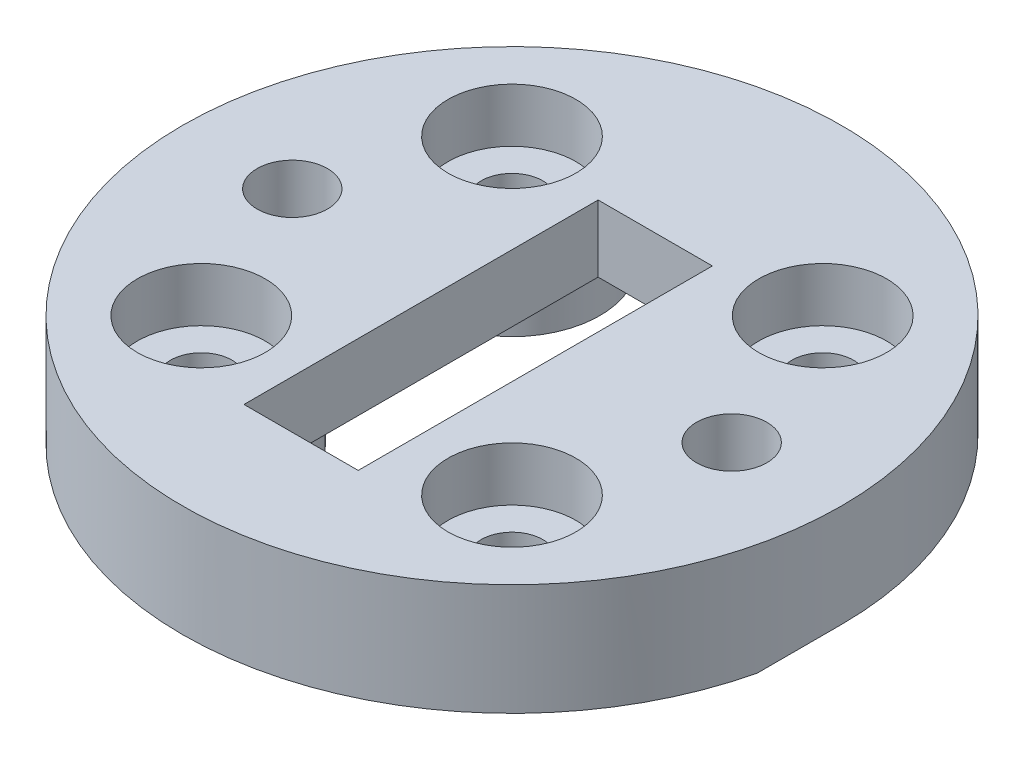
SolidWorks part; units mm, degrees
ref_plane "Front Plane" through (0, 0, 0) normal (0, 0, 1) x (1, 0, 0)
ref_plane "Top Plane" through (0, 0, 0) normal (0, 1, 0) x (1, 0, 0)
ref_plane "Right Plane" through (0, 0, 0) normal (1, 0, 0) x (0, 0, -1)
sketch "Sketch1-dovetail_male" plane through (0, 0, 0) normal (0, 0, 1) x (1, 0, 0)
  line L0 (0, 0) -> (0, 12) construction
  line L1 (-18.5, 12) -> (-18.5, 9)
  line L2 (-18.5, 9) -> (-12.5, 3)
  line L3 (-12.5, 3) -> (-12.5, 0)
  line L4 (12.5, 3) -> (12.5, 0)
  line L5 (18.5, 9) -> (12.5, 3)
  line L6 (18.5, 12) -> (18.5, 9)
  line L7 (-18.5, 12) -> (18.5, 12)
  line L8 (-12.5, 0) -> (12.5, 0)
  dimension "D1" = 12
  dimension "D2" = 3
  dimension "D3" = 45
  dimension "D4" = 25
sketch "Sketch9-dovetail_male" plane through (0, 0, -30) normal (0, 0, -1) x (-1, 0, 0)
  line L0 (0, 12) -> (0, 0) construction
  line L1 (-18.5, 12) -> (-12.5, 12)
  line L2 (-18.5, 12) -> (-18.5, 0)
  line L3 (-18.5, 0) -> (-12.5, 0)
  line L4 (-12.5, 12) -> (-12.5, 0)
  line L7 (12.5, 12) -> (12.5, 0)
  line L8 (18.5, 0) -> (12.5, 0)
  line L9 (18.5, 12) -> (18.5, 0)
  line L10 (18.5, 12) -> (12.5, 12)
sketch "Sketch10-dovetail_male" plane through (12.5, 0, 0) normal (1, 0, 0) x (0, 0, -1)
  line L0 (25, 12) -> (25, 0) construction
  circle A0 centre (25, 6) radius 2.7
  dimension "4" = 5.4
sketch "Sketch11-dovetail_male" plane through (0, 0, 0) normal (0, -1, 0) x (1, 0, 0)
  line L0 (0, -16.3) -> (0, 0) construction
  line L1 (6.5, -16.3) -> (-6.5, -16.3)
  line L2 (6.5, -16.3) -> (6.5, 24)
  line L3 (6.5, 24) -> (-6.5, 24)
  line L4 (-6.5, -16.3) -> (-6.5, 24)
  line L8 (12.5, -27.7) -> (12.5, -22.3) construction
  dimension "D3" = 6
inserted part "dovetail_male"
sketch "Sketch5" plane through (0, 0, 0) normal (0, -1, 0) x (1, 0, 0)
  circle A0 centre (0, 0) radius 37.5
  dimension "D1" = 75
extrude "UR Wrist Body" add sketch "Sketch5" along normal blind 1.5
sketch "Sketch16" plane through (0, -1.5, 0) normal (0, -1, 0) x (1, 0, 0)
  circle A0 centre (0, 0) radius 37.5
  circle A1 centre (0, 0) radius 37.5 construction
extrude "Boss-Extrude2" add sketch "Sketch16" along normal offset from surface (11.43 mm away) 12.93
sketch "Sketch26" plane through (0, 0, 0) normal (0, 1, 0) x (1, 0, 0)
  line L1 (-37.5, 0) -> (37.5, 0)
  line L2 (-37.5, 0) -> (-37.5, -60)
  line L3 (-37.5, -60) -> (37.5, -60)
  line L4 (37.5, 0) -> (37.5, -60)
  circle A0 centre (0, 0) radius 37.5 construction
  dimension "D1" = 60
extrude "Boss-Extrude4" add sketch "Sketch26" against normal up to surface (12.93 mm away)
sketch "Sketch22" plane through (0, -12.93, 0) normal (0, -1, 0) x (1, 0, 0)
  line L0 (32.5, 18.7083) -> (32.5, 55)
  line L1 (32.5, 55) -> (5, 55)
  line L2 (-32.5, 55) -> (-32.5, 18.7083)
  line L3 (32.5, 55) -> (37.5, 55) construction
  line L4 (37.5, 60) -> (37.5, 0) construction
  line L5 (32.5, 55) -> (32.5, 60) construction
  line L6 (-37.5, 60) -> (37.5, 60) construction
  line L7 (0, 37.1652) -> (0, 55) construction
  line L8 (5, 37.1652) -> (5, 55)
  line L9 (-5, 37.1652) -> (-5, 55)
  line L10 (-5, 55) -> (-32.5, 55)
  line L11 (-5, 0) -> (5, 0) construction
  line L12 (0, 0) -> (32.9658, 32.9658) construction
  line L13 (0, 0) -> (-29.7332, 29.7332) construction
  line L14 (0, 0) -> (-30.6641, -30.6641) construction
  line L15 (0, 0) -> (36.6284, -36.6284) construction
  arc A4 (32.5, 18.7083) -> (5, 37.1652) centre (0, 0) ccw
  arc A5 (-5, 37.1652) -> (-32.5, 18.7083) centre (0, 0) ccw
  arc A6 (20.1885, 27.3573) -> (-20.1885, 27.3573) centre (0, 0) ccw
  arc A11 (20.1885, 27.3573) -> (18.6499, 7.725) centre (17.6777, 17.6777) ccw
  arc A12 (-27.3573, 20.1885) -> (-24.0278, 9.9526) centre (-17.6777, 17.6777) ccw
  arc A13 (-20.1885, -27.3573) -> (-18.6499, -7.725) centre (-17.6777, -17.6777) ccw
  arc A14 (27.3573, -20.1885) -> (24.0278, -9.9526) centre (17.6777, -17.6777) ccw
  arc A15 (-27.3573, 20.1885) -> (-33.62, 5.0691) centre (0, 0) ccw
  arc A16 (-20.1885, -27.3573) -> (20.1885, -27.3573) centre (0, 0) ccw
  arc A17 (27.3573, -20.1885) -> (33.62, -5.0691) centre (0, 0) ccw
  arc A18 (18.6499, 7.725) -> (18.6499, -7.725) centre (25, 0) ccw
  arc A19 (-18.6499, -7.725) -> (-18.6499, 7.725) centre (-25, 0) ccw
  arc A20 (24.0278, 9.9526) -> (27.3573, 20.1885) centre (17.6777, 17.6777) ccw
  arc A21 (33.62, 5.0691) -> (27.3573, 20.1885) centre (0, 0) ccw
  arc A22 (33.62, 5.0691) -> (24.0278, 9.9526) centre (25, 0) ccw
  arc A23 (18.6499, -7.725) -> (20.1885, -27.3573) centre (17.6777, -17.6777) ccw
  arc A24 (24.0278, -9.9526) -> (33.62, -5.0691) centre (25, 0) ccw
  arc A25 (-24.0278, -9.9526) -> (-27.3573, -20.1885) centre (-17.6777, -17.6777) ccw
  arc A26 (-33.62, -5.0691) -> (-27.3573, -20.1885) centre (0, 0) ccw
  arc A27 (-33.62, -5.0691) -> (-24.0278, -9.9526) centre (-25, 0) ccw
  arc A28 (-18.6499, 7.725) -> (-20.1885, 27.3573) centre (-17.6777, 17.6777) ccw
  arc A29 (-24.0278, 9.9526) -> (-33.62, 5.0691) centre (-25, 0) ccw
  dimension "D1" = 45
  dimension "D2" = 90
  dimension "D3" = 75
  dimension "D7" = 68
  dimension "D8" = 90
  dimension "D10" = 20
  dimension "D15" = 20
  dimension "D16" = 20
  dimension "D6" = 5
  dimension "D9" = 90
  dimension "D11" = 25
  dimension "D12" = 25
  dimension "D13" = 25
  dimension "D14" = 25
  dimension "D17" = 25
  dimension "D18" = 25
  dimension "D4" = 5
  dimension "D5" = 5
extrude "Cut-Extrude7" cut sketch "Sketch22" against normal blind 5.08
sketch "Sketch13" plane through (0, 0, 0) normal (0, 1, 0) x (1, 0, 0)
  line L5 (-6.5, -24) -> (6.5, -24)
  line L6 (6.5, -24) -> (6.5, 16.3)
  line L7 (6.5, 16.3) -> (-6.5, 16.3)
  line L8 (-6.5, 16.3) -> (-6.5, -24)
  line L9 (-6.5, -24) -> (6.5, -24)
  line L10 (6.5, -24) -> (6.5, 16.3)
  line L11 (6.5, 16.3) -> (-6.5, 16.3)
  line L12 (-6.5, 16.3) -> (-6.5, -24)
  dimension "D1" = 0
extrude "Clearance Continuation" cut sketch "Sketch13" against normal through all
fillet "Fillet3" radius 0.5 13 edges at (0, 12, -30) (18.3536, 12, -19.8536) (12.3536, 12, -29.8536) (-12.3536, 12, -29.8536) (-18.3536, 12, -19.8536) (12.6464, 12, -20.1464) (-12.6464, 12, -20.1464) (18.5, 12, 5.25) (-18.5, 12, 5.25) (15.5, 12, -20) (12.5, 12, -25) (-15.5, 12, -20) (-12.5, 12, -25)
sketch "Sketch18" plane through (12.5, 0, 0) normal (1, 0, 0) x (0, 0, -1)
  circle A0 centre (25, 6) radius 2
  circle A1 centre (25, 6) radius 3
  dimension "D1" = 4
  dimension "D2" = 6
extrude "Boss-Extrude3" add sketch "Sketch18" against normal up to surface (25 mm away)
sketch "Sketch19" plane through (0, 0, 0) normal (0, 0, 1) x (1, 0, 0)
  line L13 (-12, 0.5) -> (-12, -0.25)
  line L14 (-12, -0.25) -> (-41.8538, -0.25)
  line L15 (-41.8538, -0.25) -> (-41.8538, 17.9915)
  line L16 (-41.8538, 17.9915) -> (46.2765, 17.9915)
  line L17 (46.2765, 17.9915) -> (46.2765, -0.25)
  line L18 (46.2765, -0.25) -> (12, -0.25)
  line L19 (12, -0.25) -> (12, 0.5)
  line L20 (37.5, 0) -> (-37.5, 0) construction
  line L25 (18, 11.5) -> (-18, 11.5)
  line L26 (-18, 11.5) -> (-18, 9.2071)
  line L27 (-18, 9.2071) -> (-12.2929, 3.5)
  line L28 (-12, 2.7929) -> (-12, 0.5)
  line L29 (-12, 0.5) -> (12, 0.5)
  line L34 (12, 0.5) -> (12, 2.7929)
  line L35 (12.2929, 3.5) -> (18, 9.2071)
  line L36 (18, 9.2071) -> (18, 11.5)
  line L37 (18, 11.5) -> (-18, 11.5)
  line L38 (-18, 11.5) -> (-18, 9.2071)
  line L39 (-18, 9.2071) -> (-12.2929, 3.5)
  line L40 (-12, 2.7929) -> (-12, 0.5)
  line L46 (12, 0.5) -> (12, 2.7929)
  line L47 (12.2929, 3.5) -> (18, 9.2071)
  line L48 (18, 9.2071) -> (18, 11.5)
  arc A14 (-12, 2.7929) -> (-12.2929, 3.5) centre (-13, 2.7929) ccw
  arc A15 (12.2929, 3.5) -> (12, 2.7929) centre (13, 2.7929) ccw
  arc A20 (-12, 2.7929) -> (-12.2929, 3.5) centre (-13, 2.7929) ccw
  arc A21 (12.2929, 3.5) -> (12, 2.7929) centre (13, 2.7929) ccw
  dimension "D2" = 0.25
  dimension "D1" = 0.5
extrude "Cut-Extrude3" cut sketch "Sketch19" against normal through all both and the other way through all
sketch "Sketch20" plane through (0, 0, 0) normal (0, 1, 0) x (1, 0, 0)
  line L0 (-12, 30) -> (13.1672, 30)
  line L1 (-12, 35.5282) -> (-12, 30) construction
  line L2 (13.1672, 30) -> (13.1672, 40.874)
  line L3 (13.1672, 40.874) -> (-13.6423, 40.874)
  line L4 (-13.6423, 40.874) -> (-12, 30)
  line L8 (-12, 30) -> (12, 30) construction
  line L9 (16.047, -54.6038) -> (15.4806, -30)
  line L10 (15.4806, -30) -> (-15.5069, -30)
  line L11 (-15.5069, -30) -> (-15.5069, -92.5118)
  line L12 (-15.5069, -92.5118) -> (15.0938, -93.6994)
  line L13 (-12, -30) -> (12, -30) construction
extrude "Cut-Extrude4" cut sketch "Sketch20" against normal up to surface (0.25 mm away)
fillet "Fillet6" radius 12.5 2 edges at (-37.5, -6.59, 60) (37.5, -6.59, 60)
chamfer "Chamfer1" distance 1 angle 45 6 edges at (0, -12.93, -37.5) (-37.5, -12.93, 23.75) (37.5, -12.93, 23.75) (0, -12.93, 60) (-33.8388, -12.93, 56.3388) (33.8388, -12.93, 56.3388)
sketch "Sketch23" plane through (0, 11.5, 0) normal (0, 1, 0) x (1, 0, 0)
  line L0 (12, 30) -> (-12, 30) construction
  line L1 (12, 30) -> (14.133, 30)
  line L2 (12, 30) -> (12, 20)
  line L3 (12, 20) -> (14.133, 20)
  line L4 (14.133, 30) -> (14.133, 20)
  line L5 (18, 20) -> (13, 20) construction
  line L6 (0, 30) -> (0, 7.83) construction
  line L7 (-12, 30) -> (-14.133, 30)
  line L8 (-14.133, 30) -> (-14.133, 20)
  line L9 (-12, 20) -> (-14.133, 20)
  line L10 (-12, 30) -> (-12, 20)
extrude "Cut-Extrude8" cut sketch "Sketch23" against normal up to surface (11.75 mm away)
sketch "Sketch27" plane through (0, -0.25, 0) normal (0, 1, 0) x (1, 0, 0)
  line L0 (-37.5, -39.8425) -> (-27.305, -39.8425) construction
  line L1 (-37.5, 0) -> (-37.5, -47.5) construction
  line L2 (-27.305, -39.8425) -> (-27.305, -51.8425) construction
  line L3 (-37.5, -42.065) -> (-29.5275, -42.065)
  line L4 (-29.5275, -42.065) -> (-29.21, -47.8425)
  line L5 (-37.5, -37.62) -> (-25.0825, -37.62)
  line L6 (-29.21, -47.8425) -> (-29.21, -51.8425)
  line L7 (-29.5275, -42.065) -> (-29.5275, -42.2306) construction
  line L8 (-25.0825, -37.62) -> (-25.0825, -42.2306) construction
  line L9 (-29.21, -51.8425) -> (-25.4, -51.8425)
  line L10 (-25.4, -51.8425) -> (-25.4, -47.8425)
  line L11 (-25.4, -47.8425) -> (-25.0825, -37.62)
  line L12 (-37.5, -37.62) -> (-37.5, -42.065)
  line L13 (0, 0) -> (0, -76.2012) construction
  line L14 (27.305, -39.8425) -> (27.305, -51.8425) construction
  line L15 (37.5, -39.8425) -> (27.305, -39.8425) construction
  line L16 (37.5, -37.62) -> (37.5, -42.065)
  line L17 (25.4, -47.8425) -> (25.0825, -37.62)
  line L18 (25.4, -51.8425) -> (25.4, -47.8425)
  line L19 (29.21, -51.8425) -> (25.4, -51.8425)
  line L20 (29.21, -47.8425) -> (29.21, -51.8425)
  line L21 (37.5, -37.62) -> (25.0825, -37.62)
  line L22 (29.5275, -42.065) -> (29.21, -47.8425)
  line L23 (37.5, -42.065) -> (29.5275, -42.065)
  line L24 (-27.305, -39.8425) -> (-27.305, -42.2306) construction
  line L25 (12, -30) -> (-12, -30) construction
  point P11 (-27.305, -51.8425)
  dimension "D3" = 3.81
  dimension "D4" = 4
  dimension "D5" = 12
  dimension "D6" = 7.62
  dimension "D7" = 50.8
  dimension "D1" = 2.2225
  dimension "D2" = 2.2225
extrude "Cut-Extrude10" cut sketch "Sketch27" against normal through all
fillet "Fillet7" radius 1.905 12 edges at (29.5275, -4.05, 42.065) (37.5, -6.09, 42.065) (37.5, -6.09, 37.62) (25.0825, -4.05, 37.62) (-37.5, -6.09, 42.065) (-29.5275, -4.05, 42.065) (-25.0825, -4.05, 37.62) (-37.5, -6.09, 37.62) (29.21, -4.05, 51.8425) (25.4, -4.05, 51.8425) (-25.4, -4.05, 51.8425) (-29.21, -4.05, 51.8425)
sketch "Sketch28" plane through (0, 11.5, 0) normal (0, 1, 0) x (1, 0, 0)
  line L0 (-6.5, -24) -> (6.5, -24) construction
  line L1 (-44.5154, -70.4281) -> (44.5154, -70.4281)
  line L2 (-44.5154, -70.4281) -> (-44.5154, -24)
  line L3 (-44.5154, -24) -> (44.5154, -24)
  line L4 (44.5154, -70.4281) -> (44.5154, -24)
  line L5 (-44.5154, -70.4281) -> (44.5154, -24) construction
  line L6 (-44.5154, -24) -> (44.5154, -70.4281) construction
  point P0 (0, -47.214)
extrude "Cut-Extrude11" [suppressed] cut sketch "Sketch28" against normal through all flip side to cut contours L2 L1 L4 L3
sketch "Sketch29" plane through (0, -12.93, 0) normal (0, -1, 0) x (1, 0, 0)
  line L11 (37.5, 0) -> (37.5, 100.5091)
  line L13 (-37.5, 0) -> (-37.5, 100.5091)
  line L14 (-37.5, 100.5091) -> (37.5, 100.5091)
  arc A2 (37.5, 0) -> (-37.5, 0) centre (0, 0) ccw
extrude "Cut-Extrude12" cut sketch "Sketch29" against normal through all
sketch "Sketch30" plane through (0, 11.5, 0) normal (0, 1, 0) x (1, 0, 0)
  circle A0 centre (0, 0) radius 37.5
extrude "Cut-Extrude13" cut sketch "Sketch30" against normal up to surface (11.75 mm away)
hole_wizard "CBORE for M6 Hex Head Bolt2" positions "Sketch31" profile "Sketch32" counterbore size "M6" standard "ANSI Metric"
sketch "Sketch31" plane through (0, -0.25, 0) normal (0, 1, 0) x (1, 0, 0)
  line L0 (-4.9486, 0) -> (8.6884, 0) construction
  line L2 (0, 0) -> (40.5592, 40.5592) construction
  line L4 (0, 0) -> (-23.5206, 23.5206) construction
  line L6 (0, 0) -> (-21.6248, -21.6248) construction
  line L8 (0, 0) -> (20.8995, -20.8995) construction
  point P0 (-17.6777, 17.6777)
  point P2 (17.6777, 17.6777)
  point P4 (17.6777, -17.6777)
  point P6 (-17.6777, -17.6777)
  dimension "D1" = 45
  dimension "D2" = 25
  dimension "D3" = 90
  dimension "D4" = 90
  dimension "D5" = 90
  dimension "D6" = 25
  dimension "D7" = 25
  dimension "D8" = 25
sketch "Sketch32" plane through (-17.6777, -0.25, -17.6777) normal (1, 0, 0) x (0, 0, 1)
  line L0 (0, 0) -> (0, 12.68)
  line L1 (0, 12.68) -> (3.5, 12.68)
  line L3 (3.5, 12.68) -> (3.5, 6.13)
  line L4 (3.5, 6.13) -> (7.275, 6.13)
  line L5 (7.275, 6.13) -> (7.275, 0)
  line L7 (7.275, 0) -> (0, 0)
  line L11 (0, -6.35) -> (0, 107.95) construction
  dimension "Thru Hole Dia." = 7
  dimension "Thru Hole Depth" = 12.68
  dimension "C'Bore Dia." = 14.55
  dimension "C'Bore Depth" = 6.13
sketch "Sketch34" plane through (0, -0.25, 0) normal (0, 1, 0) x (1, 0, 0)
  circle A0 centre (-25, 0) radius 4
  circle A1 centre (25, 0) radius 4
  dimension "D1" = 8
  dimension "D2" = 8
  dimension "D3" = 25
  dimension "D4" = 50
extrude "Cut-Extrude14" cut sketch "Sketch34" against normal blind 7.9
ref_plane "Plane1" through (0, -12.93, 0) normal (0, -1, 0) x (-1, 0, 0)
sketch "Sketch35" plane through (0, -12.93, 0) normal (0, -1, 0) x (-1, 0, 0)
  circle A3 centre (0, 0) radius 34
